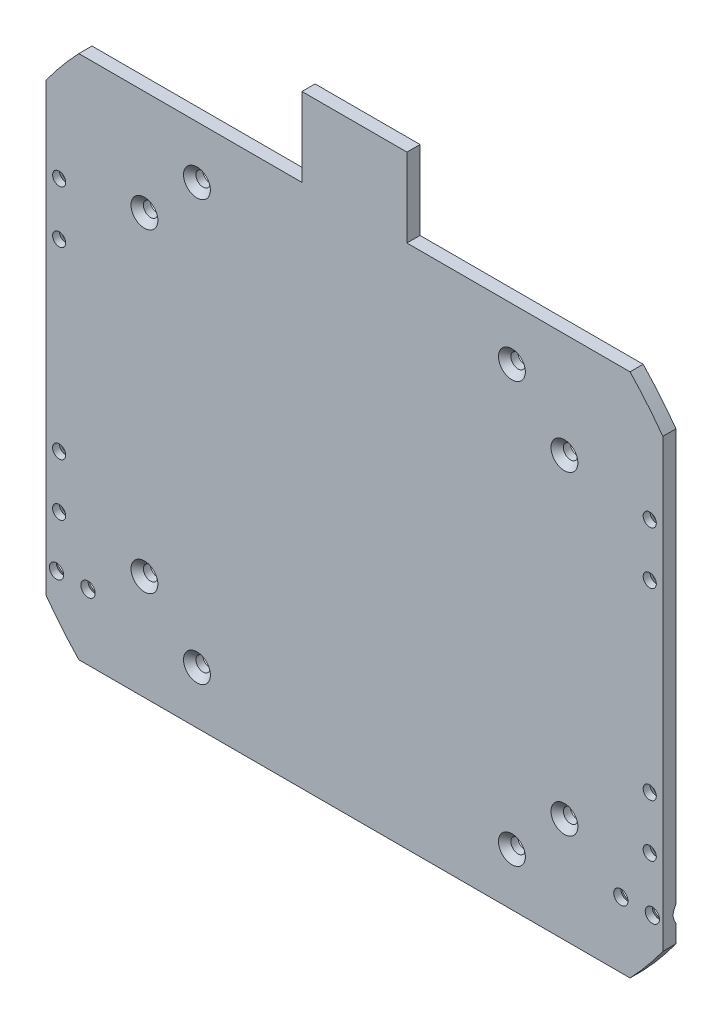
SolidWorks part; units mm, degrees
ref_plane "Front" through (0, 0, 0) normal (0, 0, 1) x (1, 0, 0)
ref_plane "Top" through (0, 0, 0) normal (0, 1, 0) x (1, 0, 0)
ref_plane "Right" through (0, 0, 0) normal (1, 0, 0) x (0, 0, -1)
sketch "Sketch1" plane through (0, 0, 0) normal (0, 0, 1) x (1, 0, 0)
  line L0 (0, 81.3381) -> (0, -84.128) construction
  line L1 (-98.6144, 0) -> (97.7559, 0) construction
  circle A0 centre (0, 0) radius 92.075
  dimension "D1" = 184.15
extrude "Base-Extrude" add sketch "Sketch1" along normal blind 3.175
sketch "Sketch2" plane through (0, 0, 3.175) normal (0, 0, 1) x (1, 0, 0)
  line L0 (-71.4375, 68.1429) -> (-71.4375, -88.5662) construction
  line L1 (71.4375, 73.6415) -> (71.4375, -92.1009) construction
  line L2 (-99.2687, 38.1) -> (100.447, 38.1) construction
  line L3 (-102.6071, -38.1) -> (76.489, -38.1) construction
  line L4 (-71.5795, 34.925) -> (82.773, 34.925) construction
  line L5 (-71.5795, 22.225) -> (82.773, 22.225) construction
  line L6 (-71.5795, -22.225) -> (76.489, -22.225) construction
  line L7 (-75.3107, -34.925) -> (72.365, -34.925) construction
  circle A0 centre (71.4375, 34.925) radius 1.5875
  circle A1 centre (71.4375, 22.225) radius 1.5875
  circle A2 centre (71.4375, -22.225) radius 1.5875
  circle A3 centre (71.4375, -34.925) radius 1.5875
  circle A4 centre (-71.4375, -22.225) radius 1.5875
  circle A5 centre (-71.4375, -34.925) radius 1.5875
  circle A6 centre (-71.4375, 34.925) radius 1.5875
  circle A7 centre (-71.4375, 22.225) radius 1.5875
  dimension "D9" = 3.175
  dimension "D10" = 3.175
  dimension "D11" = 3.175
  dimension "D12" = 3.175
  dimension "D13" = 3.175
  dimension "D14" = 3.175
  dimension "D15" = 3.175
  dimension "D16" = 3.175
  dimension "D1" = 142.875
  dimension "D2" = 71.4375
  dimension "D3" = 76.2
  dimension "D4" = 38.1
  dimension "D5" = 12.7
  dimension "D6" = 12.7
  dimension "D7" = 3.175
  dimension "D8" = 3.175
extrude "rail holes" cut sketch "Sketch2" against normal blind 3.175
sketch "Sketch4" plane through (0, 0, 3.175) normal (0, 0, 1) x (1, 0, 0)
  line L0 (0, 17.8174) -> (0, 107.5986) construction
  line L1 (-66.675, -63.5) -> (66.675, -63.5)
  line L2 (63.5, 76.5871) -> (63.5, -72.4632) construction
  line L3 (-63.5, 75.2125) -> (-63.5, -83.0676) construction
  line L4 (74.6125, 53.9516) -> (74.6125, -53.9516)
  line L5 (-74.6125, 53.9516) -> (-74.6125, -53.9516)
  line L6 (-66.675, 63.5) -> (-12.7, 63.5)
  line L8 (-12.7, 82.55) -> (12.7, 82.55)
  line L9 (-12.7, 82.55) -> (-12.7, 63.5)
  line L11 (12.7, 82.55) -> (12.7, 63.5)
  line L12 (12.7, 63.5) -> (66.675, 63.5)
  circle A0 centre (0, 0) radius 92.075 construction
  arc A1 (66.675, 63.5) -> (-66.675, 63.5) centre (0, 0) ccw
  arc A2 (-74.6125, 53.9516) -> (-74.6125, -53.9516) centre (0, 0) ccw
  arc A3 (-66.675, -63.5) -> (66.675, -63.5) centre (0, 0) ccw
  arc A4 (74.6125, -53.9516) -> (74.6125, 53.9516) centre (0, 0) ccw
  dimension "D7" = 184.15
  dimension "D1" = 127
  dimension "D2" = 63.5
  dimension "D3" = 127
  dimension "D4" = 63.5
  dimension "D5" = 149.225
  dimension "D6" = 74.6125
  dimension "D8" = 25.4
  dimension "D9" = 12.7
  dimension "D10" = 82.55
extrude "square edges" cut sketch "Sketch4" against normal through all
sketch "Sketch5" plane through (0, 0, 3.175) normal (0, 0, 1) x (1, 0, 0)
  line L0 (-38.1, 77.569) -> (-38.1, -75.2125) construction
  line L1 (38.1, 76.1944) -> (38.1, -70.6958) construction
  line L2 (50.8, 73.0524) -> (50.8, -70.6958) construction
  line L3 (-50.8, 80.5147) -> (-50.8, -75.2125) construction
  line L4 (-90.039, 38.1) -> (106.1419, 38.1) construction
  line L5 (-91.61, 50.8) -> (81.5948, 50.8) construction
  line L6 (-85.1296, -38.1) -> (88.2716, -38.1) construction
  line L7 (-82.3803, -50.8) -> (83.9513, -50.8) construction
  circle A0 centre (-38.1, 50.8) radius 1.7272
  circle A1 centre (-50.8, 38.1) radius 1.7272
  circle A2 centre (-50.8, -38.1) radius 1.7272
  circle A3 centre (-38.1, -50.8) radius 1.7272
  circle A4 centre (38.1, -50.8) radius 1.7272
  circle A5 centre (50.8, -38.1) radius 1.7272
  circle A6 centre (38.1, 50.8) radius 1.7272
  circle A7 centre (50.8, 38.1) radius 1.7272
  dimension "D9" = 3.4544
  dimension "D10" = 3.4544
  dimension "D11" = 3.4544
  dimension "D12" = 3.4544
  dimension "D13" = 3.4544
  dimension "D14" = 3.4544
  dimension "D15" = 3.4544
  dimension "D16" = 3.4544
  dimension "D1" = 38.1
  dimension "D2" = 50.8
  dimension "D3" = 101.6
  dimension "D4" = 76.2
  dimension "D5" = 101.6
  dimension "D6" = 76.2
  dimension "D7" = 38.1
  dimension "D8" = 50.8
extrude "spacer holes" cut sketch "Sketch5" against normal through all
sketch "Sketch6" plane through (0, 0, 0) normal (0, 0, -1) x (-1, 0, 0)
  circle A0 centre (-64.4525, -47.6467) radius 1.7272
  circle A1 centre (-72.0725, -47.6467) radius 1.7272
  circle A2 centre (72.0725, -47.6033) radius 1.7272
  circle A3 centre (64.4525, -47.6033) radius 1.7272
  dimension "D1" = 3.4544
  dimension "D2" = 3.4544
  dimension "D3" = 3.4544
  dimension "D4" = 3.4544
extrude "Cut-Extrude1" cut sketch "Sketch6" against normal blind 3.175
chamfer "spacer hole chamfer" distance 1.524 angle 44
chamfer "Chamfer3" distance 1.524 angle 44
